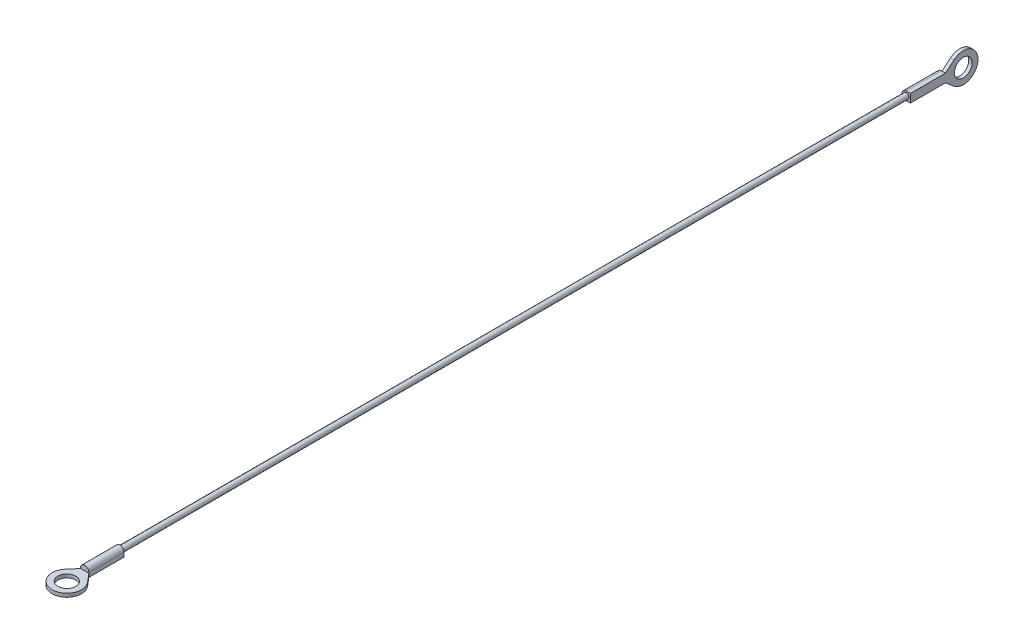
SolidWorks part; units mm, degrees
ref_plane "Front Plane" through (0, 0, 0) normal (0, 0, 1) x (1, 0, 0)
ref_plane "Top Plane" through (0, 0, 0) normal (0, 1, 0) x (1, 0, 0)
ref_plane "Right Plane" through (0, 0, 0) normal (1, 0, 0) x (0, 0, -1)
sketch "Sketch1" plane through (0, 0, 0) normal (0, 0, 1) x (1, 0, 0)
  circle A0 centre (0, 0) radius 0.795
extrude "Boss-Extrude1" add sketch "Sketch1" along normal mid plane 223.84
sketch "Sketch2" plane through (0, 0, 111.92) normal (0, 0, 1) x (1, 0, 0)
  line L0 (-1.195, 0) -> (-1.195, -1.195)
  line L1 (-1.195, -1.195) -> (0, -1.195)
  line L2 (0, -1.195) -> (1.195, -1.195)
  line L3 (1.195, -1.195) -> (1.195, 0)
  arc A0 (1.195, 0) -> (-1.195, 0) centre (0, 0) ccw
  dimension "D1" = 2.39
extrude "Boss-Extrude2" add sketch "Sketch2" along normal blind 10
sketch "Sketch3" plane through (0, -1.195, 0) normal (0, -1, 0) x (1, 0, 0)
  line L0 (1.195, 121.92) -> (3.2017, 124.2972)
  line L1 (-3.2017, 124.2972) -> (-1.195, 121.92)
  line L2 (-1.195, 121.92) -> (1.195, 121.92)
  arc A0 (3.2017, 124.2972) -> (-3.2017, 124.2972) centre (0, 127) ccw
  circle A1 centre (0, 127) radius 2.54
  point P8 (4.19, 127)
  point P9 (-4.19, 127)
  dimension "D1" = 5.08
  dimension "D2" = 8.38
  dimension "D3" = 127
extrude "Boss-Extrude3" add sketch "Sketch3" against normal blind 1.01
sketch "Sketch4" plane through (0, 0, -111.92) normal (0, 0, -1) x (-1, 0, 0)
  line L0 (0, 1.195) -> (-1.195, 1.195)
  line L1 (-1.195, 1.195) -> (-1.195, 0)
  line L2 (-1.195, 0) -> (-1.195, -1.195)
  line L3 (-1.195, -1.195) -> (0, -1.195)
  arc A0 (0, -1.195) -> (0, 1.195) centre (0, 0) ccw
  dimension "D1" = 2.39
extrude "Boss-Extrude4" add sketch "Sketch4" along normal blind 10
sketch "Sketch5" plane through (1.195, 0, 0) normal (1, 0, 0) x (0, 0, -1)
  line L0 (121.92, -1.195) -> (121.92, 1.195)
  line L1 (121.92, 1.195) -> (124.2972, 3.2017)
  line L2 (124.2972, -3.2017) -> (121.92, -1.195)
  arc A0 (124.2972, 3.2017) -> (124.2972, -3.2017) centre (127, 0) cw
  circle A1 centre (127, 0) radius 2.54
  point P8 (127, 4.19)
  point P9 (127, -4.19)
  dimension "D1" = 5.08
  dimension "D2" = 8.38
  dimension "D3" = 127
extrude "Boss-Extrude5" add sketch "Sketch5" against normal blind 1.01
